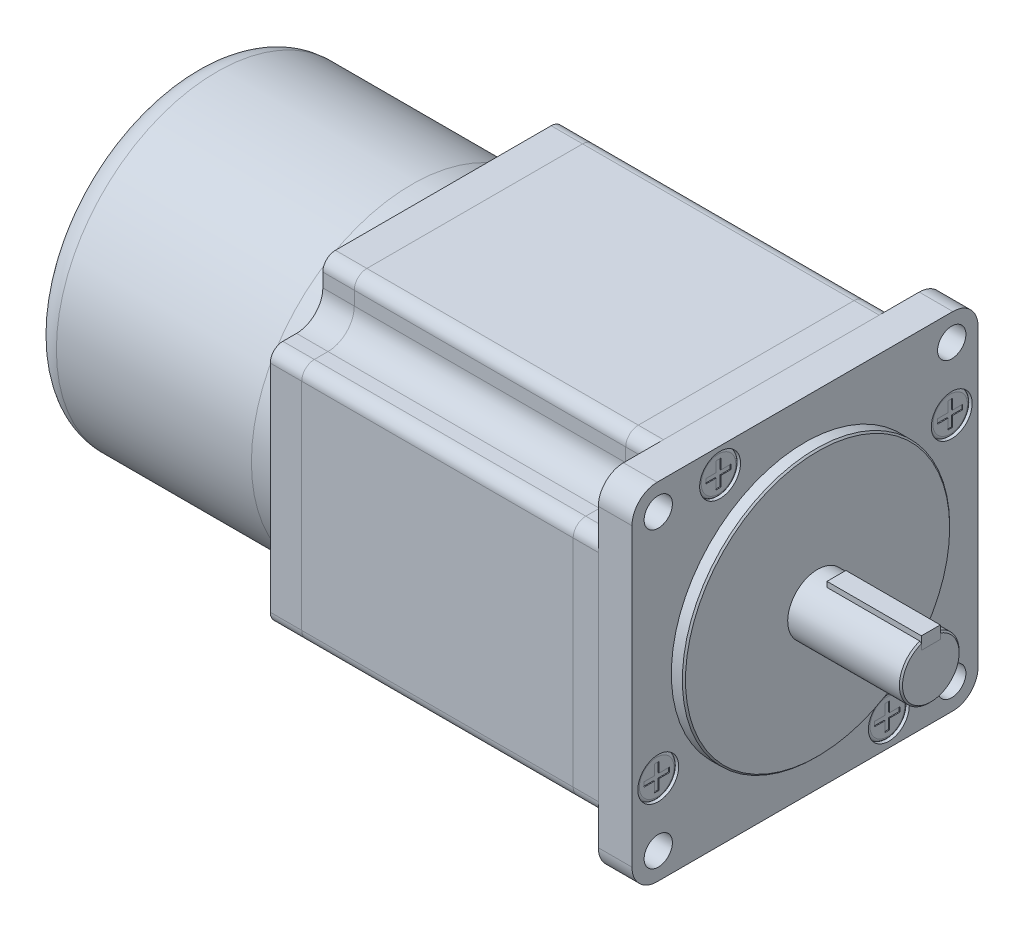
SolidWorks part; units mm, degrees
ref_plane "前视基准面" through (0, 0, 0) normal (0, 0, 1) x (1, 0, 0)
ref_plane "上视基准面" through (0, 0, 0) normal (0, 1, 0) x (1, 0, 0)
ref_plane "右视基准面" through (0, 0, 0) normal (1, 0, 0) x (0, 0, -1)
sketch "草图1" plane through (0, 0, 0) normal (1, 0, 0) x (0, 0, -1)
  line L1 (-47, -55) -> (47, -55)
  line L2 (-55, -47) -> (-55, 47)
  line L3 (-47, 55) -> (47, 55)
  line L4 (55, -47) -> (55, 47)
  line L5 (-55, -55) -> (55, 55) construction
  line L6 (-55, 55) -> (55, -55) construction
  arc A0 (-55, -47) -> (-47, -55) centre (-47, -47) ccw
  arc A1 (47, -55) -> (55, -47) centre (47, -47) ccw
  arc A2 (55, 47) -> (47, 55) centre (47, 47) ccw
  arc A3 (-55, 47) -> (-47, 55) centre (-47, 47) cw
  point P0 (0, 0)
  dimension "D1" = 8
extrude "凸台-拉伸1" add sketch "草图1" against normal blind 10.7
sketch "草图2" plane through (-10.7, 0, 0) normal (-1, 0, 0) x (0, 0, 1)
  line L0 (-55, -47) -> (-55, 47) construction
  line L1 (47, -55) -> (-47, -55)
  line L2 (55, -47) -> (55, 47)
  line L3 (47, 55) -> (-47, 55)
  line L4 (-55, -47) -> (-55, 47)
  line L5 (55, -55) -> (-55, 55) construction
  line L6 (55, 55) -> (-55, -55) construction
  arc A0 (47, -55) -> (55, -47) centre (47, -47) ccw
  arc A1 (55, 47) -> (47, 55) centre (47, 47) ccw
  arc A2 (-47, 55) -> (-55, 47) centre (-47, 47) ccw
  arc A3 (-47, -55) -> (-55, -47) centre (-47, -47) cw
  point P0 (0, 0)
  dimension "D1" = 8
extrude "凸台-拉伸2" add sketch "草图2" along normal blind 8 separate body
sketch "草图3" plane through (-18.7, 0, 0) normal (-1, 0, 0) x (0, 0, 1)
  line L0 (-55, 47) -> (-55, -47) construction
  line L1 (47, -55) -> (-47, -55)
  line L2 (55, -47) -> (55, 47)
  line L3 (47, 55) -> (-47, 55)
  line L4 (-55, -47) -> (-55, 47)
  line L5 (55, -55) -> (-55, 55) construction
  line L6 (55, 55) -> (-55, -55) construction
  arc A0 (47, -55) -> (55, -47) centre (47, -47) ccw
  arc A1 (55, 47) -> (47, 55) centre (47, 47) ccw
  arc A2 (-47, 55) -> (-55, 47) centre (-47, 47) ccw
  arc A3 (-47, -55) -> (-55, -47) centre (-47, -47) cw
  point P0 (0, 0)
  dimension "D1" = 8
extrude "凸台-拉伸3" add sketch "草图3" along normal blind 86.3 separate body
sketch "草图4" plane through (-105, 0, 0) normal (-1, 0, 0) x (0, 0, 1)
  line L0 (-46.65, -38.3) -> (-51, -38.3)
  line L1 (46.65, -38.3) -> (51, -38.3)
  line L2 (-47, -55) -> (-34.3, -55)
  line L3 (38.3, -46.65) -> (38.3, -51)
  line L5 (-55, -47) -> (-55, -34.3)
  line L6 (-55, 34.2927) -> (-55, 47)
  line L9 (-38.3, -46.65) -> (-38.3, -51)
  line L11 (-47, 55) -> (-34.2927, 55)
  line L12 (34.2927, 55) -> (47, 55)
  line L14 (55, 47) -> (55, 34.2927)
  line L15 (55, -34.3) -> (55, -47)
  line L17 (46.65, 38.2927) -> (51, 38.2927)
  line L19 (47, -55) -> (34.3, -55)
  line L20 (38.2927, 46.65) -> (38.2927, 51)
  line L23 (-38.2927, 46.65) -> (-38.2927, 51)
  line L25 (-46.65, 38.2927) -> (-51, 38.2927)
  arc A0 (-38.3, -46.65) -> (-46.65, -38.3) centre (-46.65, -46.65) ccw
  arc A1 (-46.65, 38.2927) -> (-38.2927, 46.65) centre (-46.65, 46.65) ccw
  arc A2 (38.2927, 46.65) -> (46.65, 38.2927) centre (46.65, 46.65) ccw
  arc A3 (46.65, -38.3) -> (38.3, -46.65) centre (46.65, -46.65) ccw
  arc A4 (-55, -47) -> (-47, -55) centre (-47, -47) ccw
  arc A5 (-47, 55) -> (-55, 47) centre (-47, 47) ccw
  arc A6 (55, 47) -> (47, 55) centre (47, 47) ccw
  arc A7 (47, -55) -> (55, -47) centre (47, -47) ccw
  arc A8 (38.3, -51) -> (34.3, -55) centre (34.3, -51) cw
  arc A9 (51, -38.3) -> (55, -34.3) centre (51, -34.3) ccw
  arc A10 (55, 34.2927) -> (51, 38.2927) centre (51, 34.2927) ccw
  arc A11 (38.2927, 51) -> (34.2927, 55) centre (34.2927, 51) ccw
  arc A12 (-34.2927, 55) -> (-38.2927, 51) centre (-34.2927, 51) ccw
  arc A13 (-51, 38.2927) -> (-55, 34.2927) centre (-51, 34.2927) ccw
  arc A14 (-51, -38.3) -> (-55, -34.3) centre (-51, -34.3) cw
  arc A15 (-34.3, -55) -> (-38.3, -51) centre (-34.3, -51) cw
  point P0 (0, 0)
  dimension "D1" = 4
  dimension "D2" = 4
extrude "切除-拉伸1" cut sketch "草图4" against normal blind 127.3
sketch "草图6" plane through (0, 0, 0) normal (1, 0, 0) x (0, 0, -1)
  circle A0 centre (0, 0) radius 42.5
extrude "凸台-拉伸5" add sketch "草图6" along normal blind 4
chamfer "倒角1" distance 0.5 angle 45 1 edges at (4, 0, -42.5)
sketch "草图7" plane through (4, 0, 0) normal (1, 0, 0) x (0, 0, -1)
  circle A0 centre (0, 0) radius 9.5
extrude "凸台-拉伸6" add sketch "草图7" along normal blind 36
chamfer "倒角2" distance 0.5 angle 45 1 edges at (40, 0, -9.5)
sketch "草图8" plane through (40, 0, 0) normal (1, 0, 0) x (0, 0, -1)
  line L3 (-3, 6.7) -> (-3, 9.0139)
  line L5 (3, 9.0139) -> (3, 6.7)
  line L6 (-3, 6.7) -> (3, 6.7)
  arc A0 (3, 9.0139) -> (-3, 9.0139) centre (0, 0) ccw
sketch "草图10" plane through (0, 0, 0) normal (1, 0, 0) x (0, 0, -1)
  line L1 (-46.65, -46.65) -> (46.65, -46.65)
  line L2 (-46.65, -46.65) -> (-46.65, 46.65)
  line L3 (-46.65, 46.65) -> (46.65, 46.65)
  line L4 (46.65, -46.65) -> (46.65, 46.65)
  line L5 (-46.65, -46.65) -> (46.65, 46.65) construction
  line L6 (-46.65, 46.65) -> (46.65, -46.65) construction
  circle A0 centre (46.65, 46.65) radius 4.5
  circle A1 centre (46.65, -46.65) radius 4.5
  circle A2 centre (-46.65, -46.65) radius 4.5
  circle A3 centre (-46.65, 46.65) radius 4.5
  point P0 (0, 0)
extrude "切除-拉伸3" cut sketch "草图10" against normal blind 10.7 contours L3 A3 L2 | L2 A3 L3 | L4 A0 L3 | L3 A0 L4 | L1 A1 L4 | L4 A1 L1 | L2 A2 L1 | L1 A2 L2
sketch "草图11" plane through (0, 0, 0) normal (1, 0, 0) x (0, 0, -1)
  circle A0 centre (-27, 47) radius 6.5
  circle A1 centre (46.65, 26.65) radius 6.5
  circle A2 centre (26.65, -46.65) radius 6.5
  circle A3 centre (-46.65, -26.65) radius 6.5
extrude "切除-拉伸4" cut sketch "草图11" against normal blind 1.5
sketch "草图12" plane through (-1.5, 0, 0) normal (1, 0, 0) x (0, 0, -1)
  circle A0 centre (-27, 47) radius 6.5
  circle A1 centre (46.65, 26.65) radius 6.5
  circle A2 centre (26.65, -46.65) radius 6.5
  circle A3 centre (-46.65, -26.65) radius 6.5
extrude "凸台-拉伸8" add sketch "草图12" along normal blind 1 separate body
fillet "圆角2" radius 1 1 edges at (-0.5, 47, 20.5)
fillet "圆角3" radius 1 1 edges at (-0.5, 26.65, -53.15)
fillet "圆角4" radius 1 1 edges at (-0.5, -26.65, 40.15)
fillet "圆角5" radius 1 1 edges at (-0.5, -46.65, -33.15)
sketch "草图13" plane through (-0.5, 0, 0) normal (1, 0, 0) x (0, 0, -1)
  line L0 (45.9, 25.9) -> (45.9, 22.65)
  line L1 (-27.75, 51) -> (-26.25, 51)
  line L2 (-27.75, 51) -> (-27.75, 47.75)
  line L3 (-27.75, 43) -> (-26.25, 43)
  line L4 (-26.25, 51) -> (-26.25, 47.75)
  line L5 (-47.4, -27.4) -> (-47.4, -30.65)
  line L6 (-47.4, -27.4) -> (-50.65, -27.4)
  line L7 (-23, 47.75) -> (-26.25, 47.75)
  line L8 (-23, 47.75) -> (-23, 46.25)
  line L9 (-23, 46.25) -> (-26.25, 46.25)
  line L10 (-31, 47.75) -> (-31, 46.25)
  line L11 (25.9, -45.9) -> (22.65, -45.9)
  line L12 (-47.4, -25.9) -> (-50.65, -25.9)
  line L13 (45.9, 30.65) -> (47.4, 30.65)
  line L14 (45.9, 30.65) -> (45.9, 27.4)
  line L15 (45.9, 22.65) -> (47.4, 22.65)
  line L16 (47.4, 30.65) -> (47.4, 27.4)
  line L17 (-27.75, 46.25) -> (-27.75, 43)
  line L18 (-45.9, -27.4) -> (-45.9, -30.65)
  line L19 (50.65, 27.4) -> (47.4, 27.4)
  line L20 (50.65, 27.4) -> (50.65, 25.9)
  line L21 (50.65, 25.9) -> (47.4, 25.9)
  line L22 (42.65, 27.4) -> (42.65, 25.9)
  line L25 (25.9, -42.65) -> (27.4, -42.65)
  line L26 (25.9, -42.65) -> (25.9, -45.9)
  line L27 (25.9, -50.65) -> (27.4, -50.65)
  line L28 (27.4, -42.65) -> (27.4, -45.9)
  line L31 (30.65, -45.9) -> (27.4, -45.9)
  line L32 (30.65, -45.9) -> (30.65, -47.4)
  line L33 (30.65, -47.4) -> (27.4, -47.4)
  line L34 (22.65, -45.9) -> (22.65, -47.4)
  line L37 (-47.4, -22.65) -> (-45.9, -22.65)
  line L38 (-47.4, -22.65) -> (-47.4, -25.9)
  line L39 (-47.4, -30.65) -> (-45.9, -30.65)
  line L40 (-45.9, -22.65) -> (-45.9, -25.9)
  line L41 (27.4, -47.4) -> (27.4, -50.65)
  line L43 (-42.65, -25.9) -> (-45.9, -25.9)
  line L44 (-42.65, -25.9) -> (-42.65, -27.4)
  line L45 (-42.65, -27.4) -> (-45.9, -27.4)
  line L46 (-50.65, -25.9) -> (-50.65, -27.4)
  line L48 (25.9, -47.4) -> (22.65, -47.4)
  line L49 (25.9, -47.4) -> (25.9, -50.65)
  line L50 (-27.75, 46.25) -> (-31, 46.25)
  line L51 (-26.25, 46.25) -> (-26.25, 43)
  line L52 (-27.75, 47.75) -> (-31, 47.75)
  line L53 (45.9, 25.9) -> (42.65, 25.9)
  line L54 (47.4, 25.9) -> (47.4, 22.65)
  line L55 (45.9, 27.4) -> (42.65, 27.4)
  point P0 (-27, 47)
  point P6 (-27, 47)
  point P11 (46.65, 26.65)
  point P17 (46.65, 26.65)
  point P22 (26.65, -46.65)
  point P28 (26.65, -46.65)
  point P33 (-46.65, -26.65)
  point P39 (-46.65, -26.65)
extrude "切除-拉伸5" cut sketch "草图13" against normal blind 0.3
sketch "草图14" plane through (-105, 0, 0) normal (-1, 0, 0) x (0, 0, 1)
  line L0 (-51, -38.3) -> (-46.3, -38.3073)
  line L1 (-34.3, -55) -> (34.3, -55)
  line L4 (55, -34.3) -> (55, 34.2927)
  line L6 (-55, -34.3) -> (-55, 34.2927)
  line L7 (-38.3, -46.65) -> (-38.3, -51)
  line L8 (-34.3, -55) -> (34.3, -55)
  line L10 (38.3, -51) -> (38.3, -46.65)
  line L12 (46.65, -38.3) -> (51, -38.3)
  line L14 (55, -34.3) -> (55, 34.2927)
  line L16 (51, 38.2927) -> (46.65, 38.2927)
  line L18 (38.2927, 46.65) -> (38.2927, 51)
  line L19 (34.2927, 55) -> (-34.2927, 55)
  line L21 (-38.2927, 51) -> (-38.2927, 46.65)
  line L23 (-46.65, 38.2927) -> (-51, 38.2927)
  line L25 (-34.2927, 55) -> (34.2927, 55)
  line L27 (55, 46.3) -> (55, 47)
  arc A0 (-38.3, -46.65) -> (-46.9739, -38.3063) centre (-46.65, -46.65) ccw
  arc A2 (38.2927, 46.65) -> (46.65, 38.2927) centre (46.65, 46.65) ccw
  arc A3 (46.65, -38.3) -> (38.3, -46.65) centre (46.65, -46.65) ccw
  arc A4 (34.3, -55) -> (38.3, -51) centre (34.3, -51) ccw
  arc A5 (51, -38.3) -> (55, -34.3) centre (51, -34.3) ccw
  arc A6 (55, 34.2927) -> (51, 38.2927) centre (51, 34.2927) ccw
  arc A7 (38.2927, 51) -> (34.2927, 55) centre (34.2927, 51) ccw
  arc A8 (-34.2927, 55) -> (-38.2927, 51) centre (-34.2927, 51) ccw
  arc A9 (-51, 38.2927) -> (-55, 34.2927) centre (-51, 34.2927) ccw
  arc A10 (-55, -34.3) -> (-51, -38.3) centre (-51, -34.3) ccw
  arc A11 (-38.3, -51) -> (-34.3, -55) centre (-34.3, -51) ccw
  arc A12 (38.2927, 51) -> (34.2927, 55) centre (34.2927, 51) ccw
  arc A13 (-46.65, 38.2927) -> (-38.2927, 46.65) centre (-46.65, 46.65) ccw
  arc A16 (55, 46.3) -> (55, 47) centre (46.65, 46.65) ccw
  point P0 (0, 0)
extrude "凸台-拉伸10" add sketch "草图14" along normal blind 10 separate body
sketch "草图15" plane through (-115, 0, 0) normal (-1, 0, 0) x (0, 0, 1)
  circle A0 centre (0, 0) radius 51
extrude "凸台-拉伸11" add sketch "草图15" along normal blind 10
extrude "切除-拉伸6" cut sketch "草图8" against normal blind 30
sketch "草图16" plane through (0, 6.7, 0) normal (0, 1, 0) x (1, 0, 0)
  line L0 (40, -3) -> (40, 3)
  line L1 (40, 3) -> (10, 3)
  line L2 (10, 3) -> (10, -3)
  line L3 (10, -3) -> (40, -3)
extrude "凸台-拉伸12" add sketch "草图16" along normal blind 4 separate body
sketch "草图17" plane through (-125, 0, 0) normal (-1, 0, 0) x (0, 0, 1)
  circle A0 centre (0, 0) radius 51
extrude "凸台-拉伸13" add sketch "草图17" along normal blind 70 separate body
fillet "圆角6" radius 8 1 edges at (-195, 0, 51)
